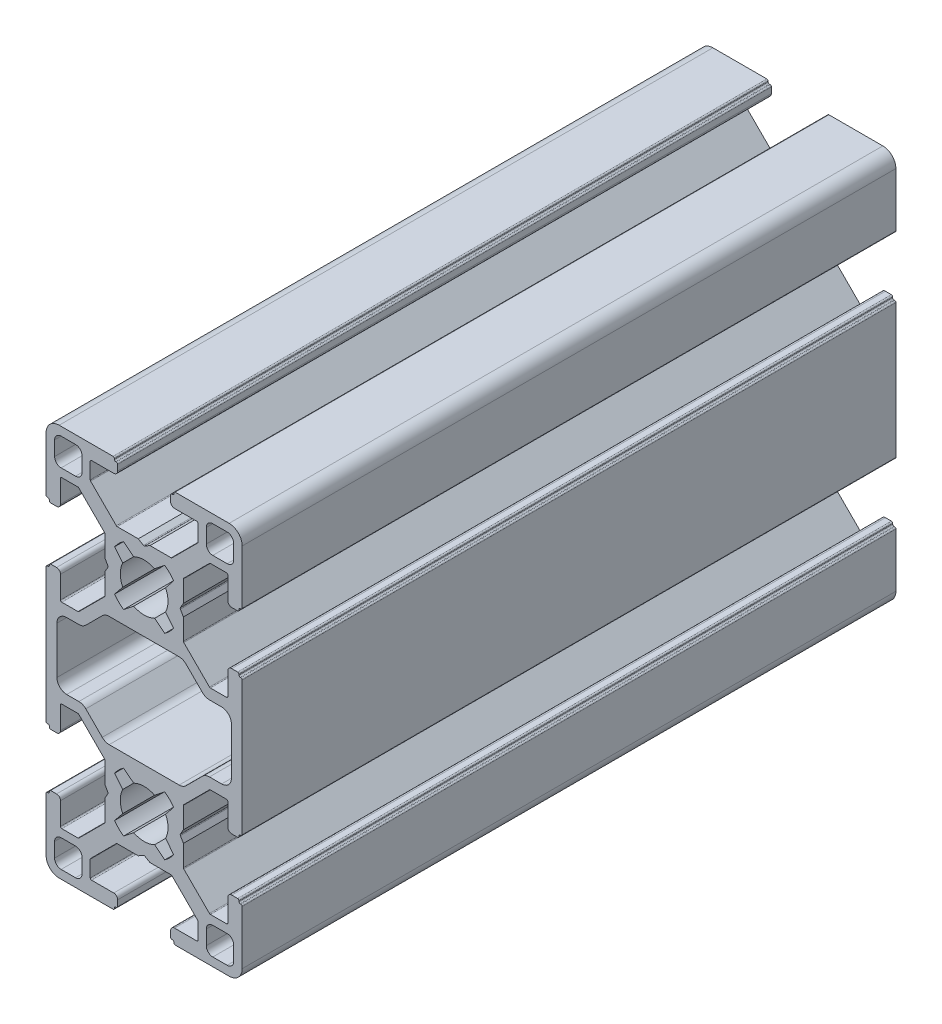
SolidWorks part; units mm, degrees
ref_plane "Front Plane" through (0, 0, 0) normal (0, 0, 1) x (1, 0, 0)
ref_plane "Top Plane" through (0, 0, 0) normal (0, 1, 0) x (1, 0, 0)
ref_plane "Right Plane" through (0, 0, 0) normal (1, 0, 0) x (0, 0, -1)
sketch "Sketch1" plane through (0, 0, 0) normal (0, 0, 1) x (1, 0, 0)
  line L0 (15.3348, -15) -> (-18.6959, -15) construction
  line L1 (-20.9994, 0) -> (26.1762, 0) construction
  line L2 (1.6001, -18.2806) -> (3.1547, -19.5053)
  line L3 (4.1172, -21) -> (0.9, -21)
  line L4 (4.35, -29.5) -> (4.25, -29.5)
  line L5 (4.05, -29.3) -> (4.05, -28.4)
  line L6 (4.55, -29.7) -> (4.55, -29.8)
  line L7 (0.9, -21) -> (0.1019, -20.5392)
  line L8 (1.6001, -11.7194) -> (3.1547, -10.4947)
  line L9 (3.2806, -13.3999) -> (4.5184, -11.8641)
  line L10 (3.2806, -16.6001) -> (4.5184, -18.1359)
  line L11 (6.0045, -19.1216) -> (6.0045, -15.9)
  line L12 (12.6, -23.25) -> (10.1328, -23.25)
  line L13 (10.5, -24.5) -> (12.7, -24.5)
  line L14 (12.7, -28.7) -> (10.5, -28.7)
  line L15 (15, -28) -> (15, -19.75)
  line L16 (13.7, -25.5) -> (13.7, -27.7)
  line L17 (14.8, -19.55) -> (14.7, -19.55)
  line L18 (14.5, -19.35) -> (14.5, -19.25)
  line L19 (14.3, -19.05) -> (13.4, -19.05)
  line L20 (12.8, -19.65) -> (12.8, -23.05)
  line L21 (8.25, -27.6) -> (8.25, -25.1328)
  line L22 (9.5, -27.7) -> (9.5, -25.5)
  line L23 (9.9914, -23.1914) -> (6.063, -19.263)
  line L24 (12.8, -10.35) -> (12.8, -6.95)
  line L25 (15, 10.25) -> (15, -10.25)
  line L26 (9.9914, -6.8086) -> (6.063, -10.737)
  line L27 (8.9272, -5.5393) -> (6.4104, -8.0562)
  line L28 (14.3, -10.95) -> (13.4, -10.95)
  line L29 (14.5, -10.65) -> (14.5, -10.75)
  line L30 (14.8, -10.45) -> (14.7, -10.45)
  line L31 (6.0045, -10.8784) -> (6.0045, -14.1)
  line L32 (6.0045, -15.9) -> (5.5426, -15.1)
  line L33 (6.0045, -14.1) -> (5.5426, -14.9)
  line L34 (12.6, -6.75) -> (10.1328, -6.75)
  line L35 (11.85, -5.1) -> (9.9879, -5.1)
  line L36 (13.35, 3.6) -> (13.35, -3.6)
  line L37 (4.75, -30) -> (13, -30)
  line L38 (8.1914, -24.9914) -> (4.2586, -21.0586)
  line L39 (4.65, -27.8) -> (8.05, -27.8)
  line L40 (-1.6001, 18.2806) -> (-3.1547, 19.5053)
  line L41 (-4.1172, 21) -> (-0.9, 21)
  line L42 (-4.35, 29.5) -> (-4.25, 29.5)
  line L43 (-4.05, 29.3) -> (-4.05, 28.4)
  line L44 (-4.55, 29.7) -> (-4.55, 29.8)
  line L45 (-0.9, 21) -> (-0.1019, 20.5392)
  line L46 (-1.6001, 11.7194) -> (-3.1547, 10.4947)
  line L47 (-5.3497, 8.4955) -> (5.3497, 8.4955)
  line L48 (-3.2806, 13.3999) -> (-4.5184, 11.8641)
  line L49 (-3.2806, 16.6001) -> (-4.5184, 18.1359)
  line L50 (-6.0045, 19.1216) -> (-6.0045, 15.9)
  line L51 (-12.6, 23.25) -> (-10.1328, 23.25)
  line L52 (-10.5, 24.5) -> (-12.7, 24.5)
  line L53 (-12.7, 28.7) -> (-10.5, 28.7)
  line L54 (-15, 28) -> (-15, 19.75)
  line L55 (-13.7, 25.5) -> (-13.7, 27.7)
  line L56 (-14.8, 19.55) -> (-14.7, 19.55)
  line L57 (-14.5, 19.35) -> (-14.5, 19.25)
  line L58 (-14.3, 19.05) -> (-13.4, 19.05)
  line L59 (-12.8, 19.65) -> (-12.8, 23.05)
  line L60 (-8.25, 27.6) -> (-8.25, 25.1328)
  line L61 (-9.5, 27.7) -> (-9.5, 25.5)
  line L62 (-9.9914, 23.1914) -> (-6.063, 19.263)
  line L63 (-12.8, 10.35) -> (-12.8, 6.95)
  line L64 (-9.9914, 6.8086) -> (-6.063, 10.737)
  line L65 (-8.9272, 5.5393) -> (-6.4104, 8.0562)
  line L66 (-14.3, 10.95) -> (-13.4, 10.95)
  line L67 (-14.5, 10.65) -> (-14.5, 10.75)
  line L68 (-14.8, 10.45) -> (-14.7, 10.45)
  line L69 (-6.0045, 10.8784) -> (-6.0045, 14.1)
  line L70 (-6.0045, 15.9) -> (-5.5426, 15.1)
  line L71 (-6.0045, 14.1) -> (-5.5426, 14.9)
  line L72 (-12.6, 6.75) -> (-10.1328, 6.75)
  line L73 (-11.85, 5.1) -> (-9.9879, 5.1)
  line L74 (-4.75, 30) -> (-13, 30)
  line L75 (-8.1914, 24.9914) -> (-4.2586, 21.0586)
  line L76 (-4.65, 27.8) -> (-8.05, 27.8)
  line L77 (4.65, 27.8) -> (8.05, 27.8)
  line L78 (8.1914, 24.9914) -> (4.2586, 21.0586)
  line L79 (4.75, 30) -> (13, 30)
  line L80 (11.85, 5.1) -> (9.9879, 5.1)
  line L81 (12.6, 6.75) -> (10.1328, 6.75)
  line L82 (6.0045, 14.1) -> (5.5426, 14.9)
  line L83 (6.0045, 15.9) -> (5.5426, 15.1)
  line L84 (6.0045, 10.8784) -> (6.0045, 14.1)
  line L85 (14.8, 10.45) -> (14.7, 10.45)
  line L86 (14.5, 10.65) -> (14.5, 10.75)
  line L87 (14.3, 10.95) -> (13.4, 10.95)
  line L88 (8.9272, 5.5393) -> (6.4104, 8.0562)
  line L89 (9.9914, 6.8086) -> (6.063, 10.737)
  line L90 (12.8, 10.35) -> (12.8, 6.95)
  line L91 (9.9914, 23.1914) -> (6.063, 19.263)
  line L92 (9.5, 27.7) -> (9.5, 25.5)
  line L93 (8.25, 27.6) -> (8.25, 25.1328)
  line L94 (12.8, 19.65) -> (12.8, 23.05)
  line L95 (14.3, 19.05) -> (13.4, 19.05)
  line L96 (14.5, 19.35) -> (14.5, 19.25)
  line L97 (14.8, 19.55) -> (14.7, 19.55)
  line L98 (13.7, 25.5) -> (13.7, 27.7)
  line L99 (15, 28) -> (15, 19.75)
  line L100 (12.7, 28.7) -> (10.5, 28.7)
  line L101 (10.5, 24.5) -> (12.7, 24.5)
  line L102 (12.6, 23.25) -> (10.1328, 23.25)
  line L103 (6.0045, 19.1216) -> (6.0045, 15.9)
  line L104 (3.2806, 16.6001) -> (4.5184, 18.1359)
  line L105 (3.2806, 13.3999) -> (4.5184, 11.8641)
  line L106 (1.6001, 11.7194) -> (3.1547, 10.4947)
  line L107 (0.9, 21) -> (0.1019, 20.5392)
  line L108 (4.55, 29.7) -> (4.55, 29.8)
  line L109 (4.05, 29.3) -> (4.05, 28.4)
  line L110 (4.35, 29.5) -> (4.25, 29.5)
  line L111 (4.1172, 21) -> (0.9, 21)
  line L112 (1.6001, 18.2806) -> (3.1547, 19.5053)
  line L155 (0, 26.7355) -> (0, -34.1789) construction
  line L156 (-4.65, -27.8) -> (-8.05, -27.8)
  line L157 (-8.1914, -24.9914) -> (-4.2586, -21.0586)
  line L158 (-4.75, -30) -> (-13, -30)
  line L162 (-13.35, 3.6) -> (-13.35, -3.6)
  line L163 (-11.85, -5.1) -> (-9.9879, -5.1)
  line L164 (-12.6, -6.75) -> (-10.1328, -6.75)
  line L165 (-6.0045, -14.1) -> (-5.5426, -14.9)
  line L166 (-6.0045, -15.9) -> (-5.5426, -15.1)
  line L167 (-6.0045, -10.8784) -> (-6.0045, -14.1)
  line L168 (-14.8, -10.45) -> (-14.7, -10.45)
  line L169 (-14.5, -10.65) -> (-14.5, -10.75)
  line L170 (-14.3, -10.95) -> (-13.4, -10.95)
  line L171 (-8.9272, -5.5393) -> (-6.4104, -8.0562)
  line L172 (-9.9914, -6.8086) -> (-6.063, -10.737)
  line L173 (-15, 10.25) -> (-15, -10.25)
  line L174 (-12.8, -10.35) -> (-12.8, -6.95)
  line L176 (-9.9914, -23.1914) -> (-6.063, -19.263)
  line L177 (-9.5, -27.7) -> (-9.5, -25.5)
  line L178 (-8.25, -27.6) -> (-8.25, -25.1328)
  line L179 (-12.8, -19.65) -> (-12.8, -23.05)
  line L180 (-14.3, -19.05) -> (-13.4, -19.05)
  line L181 (-14.5, -19.35) -> (-14.5, -19.25)
  line L182 (-14.8, -19.55) -> (-14.7, -19.55)
  line L183 (-13.7, -25.5) -> (-13.7, -27.7)
  line L184 (-15, -28) -> (-15, -19.75)
  line L185 (-12.7, -28.7) -> (-10.5, -28.7)
  line L186 (-10.5, -24.5) -> (-12.7, -24.5)
  line L187 (-12.6, -23.25) -> (-10.1328, -23.25)
  line L188 (-6.0045, -19.1216) -> (-6.0045, -15.9)
  line L214 (-3.2806, -16.6001) -> (-4.5184, -18.1359)
  line L215 (-3.2806, -13.3999) -> (-4.5184, -11.8641)
  line L216 (-5.3497, -8.4955) -> (5.3497, -8.4955)
  line L217 (-1.6001, -11.7194) -> (-3.1547, -10.4947)
  line L226 (-0.9, -21) -> (-0.1019, -20.5392)
  line L234 (-4.55, -29.7) -> (-4.55, -29.8)
  line L235 (-4.05, -29.3) -> (-4.05, -28.4)
  line L236 (-4.35, -29.5) -> (-4.25, -29.5)
  line L237 (-4.1172, -21) -> (-0.9, -21)
  line L238 (-1.6001, -18.2806) -> (-3.1547, -19.5053)
  arc A0 (4.5184, -18.1359) -> (3.1547, -19.5053) centre (0, -15) cw
  arc A1 (4.35, -29.5) -> (4.55, -29.7) centre (4.35, -29.7) cw
  arc A2 (4.25, -29.5) -> (4.05, -29.3) centre (4.25, -29.3) cw
  arc A3 (4.75, -30) -> (4.55, -29.8) centre (4.75, -29.8) cw
  arc A4 (4.05, -28.4) -> (4.65, -27.8) centre (4.65, -28.4) cw
  arc A5 (4.1172, -21) -> (4.2586, -21.0586) centre (4.1172, -21.2) cw
  arc A6 (3.2806, -13.3999) -> (3.2806, -16.6001) centre (0, -15) cw
  arc A7 (3.1547, -10.4947) -> (4.5184, -11.8641) centre (0, -15) cw
  arc A8 (12.6, -6.75) -> (12.8, -6.95) centre (12.6, -6.95) cw
  arc A9 (13.35, -3.6) -> (11.85, -5.1) centre (11.85, -3.6) cw
  arc A10 (9.9914, -6.8086) -> (10.1328, -6.75) centre (10.1328, -6.95) cw
  arc A11 (8.9272, -5.5393) -> (9.9879, -5.1) centre (9.9879, -6.6) cw
  arc A12 (15, -28) -> (13, -30) centre (13, -28) cw
  arc A13 (12.7, -24.5) -> (13.7, -25.5) centre (12.7, -25.5) cw
  arc A14 (13.7, -27.7) -> (12.7, -28.7) centre (12.7, -27.7) cw
  arc A15 (14.7, -19.55) -> (14.5, -19.35) centre (14.7, -19.35) cw
  arc A16 (14.8, -19.55) -> (15, -19.75) centre (14.8, -19.75) cw
  arc A17 (14.3, -19.05) -> (14.5, -19.25) centre (14.3, -19.25) cw
  arc A18 (12.8, -19.65) -> (13.4, -19.05) centre (13.4, -19.65) cw
  arc A19 (12.8, -23.05) -> (12.6, -23.25) centre (12.6, -23.05) cw
  arc A20 (9.5, -25.5) -> (10.5, -24.5) centre (10.5, -25.5) cw
  arc A21 (8.1914, -24.9914) -> (8.25, -25.1328) centre (8.05, -25.1328) cw
  arc A22 (8.25, -27.6) -> (8.05, -27.8) centre (8.05, -27.6) cw
  arc A23 (10.5, -28.7) -> (9.5, -27.7) centre (10.5, -27.7) cw
  arc A24 (10.1328, -23.25) -> (9.9914, -23.1914) centre (10.1328, -23.05) cw
  arc A25 (6.063, -19.263) -> (6.0045, -19.1216) centre (6.2045, -19.1216) cw
  arc A26 (14.5, -10.75) -> (14.3, -10.95) centre (14.3, -10.75) cw
  arc A27 (15, -10.25) -> (14.8, -10.45) centre (14.8, -10.25) cw
  arc A28 (14.5, -10.65) -> (14.7, -10.45) centre (14.7, -10.65) cw
  arc A29 (13.4, -10.95) -> (12.8, -10.35) centre (13.4, -10.35) cw
  arc A30 (5.5426, -15.1) -> (5.5426, -14.9) centre (5.7158, -15) cw
  arc A31 (6.0045, -10.8784) -> (6.063, -10.737) centre (6.2045, -10.8784) cw
  arc A32 (6.4104, -8.0562) -> (5.3497, -8.4955) centre (5.3497, -6.9955) cw
  arc A33 (-1.6001, 18.2806) -> (1.6001, 18.2806) centre (0, 15) cw
  arc A34 (1.6001, 11.7194) -> (-1.6001, 11.7194) centre (0, 15) cw
  arc A35 (-4.5184, 18.1359) -> (-3.1547, 19.5053) centre (0, 15) cw
  arc A36 (-4.35, 29.5) -> (-4.55, 29.7) centre (-4.35, 29.7) cw
  arc A37 (-4.25, 29.5) -> (-4.05, 29.3) centre (-4.25, 29.3) cw
  arc A38 (-4.75, 30) -> (-4.55, 29.8) centre (-4.75, 29.8) cw
  arc A39 (-4.05, 28.4) -> (-4.65, 27.8) centre (-4.65, 28.4) cw
  arc A40 (-4.1172, 21) -> (-4.2586, 21.0586) centre (-4.1172, 21.2) cw
  arc A41 (0.1019, 20.5392) -> (-0.1019, 20.5392) centre (0, 20.7158) cw
  arc A42 (-3.2806, 13.3999) -> (-3.2806, 16.6001) centre (0, 15) cw
  arc A43 (-3.1547, 10.4947) -> (-4.5184, 11.8641) centre (0, 15) cw
  arc A44 (-12.6, 6.75) -> (-12.8, 6.95) centre (-12.6, 6.95) cw
  arc A45 (-13.35, 3.6) -> (-11.85, 5.1) centre (-11.85, 3.6) cw
  arc A46 (-9.9914, 6.8086) -> (-10.1328, 6.75) centre (-10.1328, 6.95) cw
  arc A47 (-8.9272, 5.5393) -> (-9.9879, 5.1) centre (-9.9879, 6.6) cw
  arc A48 (-15, 28) -> (-13, 30) centre (-13, 28) cw
  arc A49 (-12.7, 24.5) -> (-13.7, 25.5) centre (-12.7, 25.5) cw
  arc A50 (-13.7, 27.7) -> (-12.7, 28.7) centre (-12.7, 27.7) cw
  arc A51 (-14.7, 19.55) -> (-14.5, 19.35) centre (-14.7, 19.35) cw
  arc A52 (-14.8, 19.55) -> (-15, 19.75) centre (-14.8, 19.75) cw
  arc A53 (-14.3, 19.05) -> (-14.5, 19.25) centre (-14.3, 19.25) cw
  arc A54 (-12.8, 19.65) -> (-13.4, 19.05) centre (-13.4, 19.65) cw
  arc A55 (-12.8, 23.05) -> (-12.6, 23.25) centre (-12.6, 23.05) cw
  arc A56 (-9.5, 25.5) -> (-10.5, 24.5) centre (-10.5, 25.5) cw
  arc A57 (-8.1914, 24.9914) -> (-8.25, 25.1328) centre (-8.05, 25.1328) cw
  arc A58 (-8.25, 27.6) -> (-8.05, 27.8) centre (-8.05, 27.6) cw
  arc A59 (-10.5, 28.7) -> (-9.5, 27.7) centre (-10.5, 27.7) cw
  arc A60 (-10.1328, 23.25) -> (-9.9914, 23.1914) centre (-10.1328, 23.05) cw
  arc A61 (-6.063, 19.263) -> (-6.0045, 19.1216) centre (-6.2045, 19.1216) cw
  arc A62 (-14.5, 10.75) -> (-14.3, 10.95) centre (-14.3, 10.75) cw
  arc A63 (-15, 10.25) -> (-14.8, 10.45) centre (-14.8, 10.25) cw
  arc A64 (-14.5, 10.65) -> (-14.7, 10.45) centre (-14.7, 10.65) cw
  arc A65 (-13.4, 10.95) -> (-12.8, 10.35) centre (-13.4, 10.35) cw
  arc A66 (-5.5426, 15.1) -> (-5.5426, 14.9) centre (-5.7158, 15) cw
  arc A67 (-6.0045, 10.8784) -> (-6.063, 10.737) centre (-6.2045, 10.8784) cw
  arc A68 (-6.4104, 8.0562) -> (-5.3497, 8.4955) centre (-5.3497, 6.9955) cw
  arc A69 (6.4104, 8.0562) -> (5.3497, 8.4955) centre (5.3497, 6.9955) ccw
  arc A70 (6.0045, 10.8784) -> (6.063, 10.737) centre (6.2045, 10.8784) ccw
  arc A71 (5.5426, 15.1) -> (5.5426, 14.9) centre (5.7158, 15) ccw
  arc A72 (13.4, 10.95) -> (12.8, 10.35) centre (13.4, 10.35) ccw
  arc A73 (14.5, 10.65) -> (14.7, 10.45) centre (14.7, 10.65) ccw
  arc A74 (15, 10.25) -> (14.8, 10.45) centre (14.8, 10.25) ccw
  arc A75 (14.5, 10.75) -> (14.3, 10.95) centre (14.3, 10.75) ccw
  arc A76 (6.063, 19.263) -> (6.0045, 19.1216) centre (6.2045, 19.1216) ccw
  arc A77 (10.1328, 23.25) -> (9.9914, 23.1914) centre (10.1328, 23.05) ccw
  arc A78 (10.5, 28.7) -> (9.5, 27.7) centre (10.5, 27.7) ccw
  arc A79 (8.25, 27.6) -> (8.05, 27.8) centre (8.05, 27.6) ccw
  arc A80 (8.1914, 24.9914) -> (8.25, 25.1328) centre (8.05, 25.1328) ccw
  arc A81 (9.5, 25.5) -> (10.5, 24.5) centre (10.5, 25.5) ccw
  arc A82 (12.8, 23.05) -> (12.6, 23.25) centre (12.6, 23.05) ccw
  arc A83 (12.8, 19.65) -> (13.4, 19.05) centre (13.4, 19.65) ccw
  arc A84 (14.3, 19.05) -> (14.5, 19.25) centre (14.3, 19.25) ccw
  arc A85 (14.8, 19.55) -> (15, 19.75) centre (14.8, 19.75) ccw
  arc A86 (14.7, 19.55) -> (14.5, 19.35) centre (14.7, 19.35) ccw
  arc A87 (13.7, 27.7) -> (12.7, 28.7) centre (12.7, 27.7) ccw
  arc A88 (12.7, 24.5) -> (13.7, 25.5) centre (12.7, 25.5) ccw
  arc A89 (15, 28) -> (13, 30) centre (13, 28) ccw
  arc A90 (8.9272, 5.5393) -> (9.9879, 5.1) centre (9.9879, 6.6) ccw
  arc A91 (9.9914, 6.8086) -> (10.1328, 6.75) centre (10.1328, 6.95) ccw
  arc A92 (13.35, 3.6) -> (11.85, 5.1) centre (11.85, 3.6) ccw
  arc A93 (12.6, 6.75) -> (12.8, 6.95) centre (12.6, 6.95) ccw
  arc A94 (3.1547, 10.4947) -> (4.5184, 11.8641) centre (0, 15) ccw
  arc A95 (3.2806, 13.3999) -> (3.2806, 16.6001) centre (0, 15) ccw
  arc A96 (4.1172, 21) -> (4.2586, 21.0586) centre (4.1172, 21.2) ccw
  arc A97 (4.05, 28.4) -> (4.65, 27.8) centre (4.65, 28.4) ccw
  arc A98 (4.75, 30) -> (4.55, 29.8) centre (4.75, 29.8) ccw
  arc A99 (4.25, 29.5) -> (4.05, 29.3) centre (4.25, 29.3) ccw
  arc A100 (4.35, 29.5) -> (4.55, 29.7) centre (4.35, 29.7) ccw
  arc A101 (4.5184, 18.1359) -> (3.1547, 19.5053) centre (0, 15) ccw
  arc A138 (-6.4104, -8.0562) -> (-5.3497, -8.4955) centre (-5.3497, -6.9955) ccw
  arc A140 (-6.0045, -10.8784) -> (-6.063, -10.737) centre (-6.2045, -10.8784) ccw
  arc A141 (-5.5426, -15.1) -> (-5.5426, -14.9) centre (-5.7158, -15) ccw
  arc A142 (-13.4, -10.95) -> (-12.8, -10.35) centre (-13.4, -10.35) ccw
  arc A143 (-14.5, -10.65) -> (-14.7, -10.45) centre (-14.7, -10.65) ccw
  arc A144 (-15, -10.25) -> (-14.8, -10.45) centre (-14.8, -10.25) ccw
  arc A145 (-14.5, -10.75) -> (-14.3, -10.95) centre (-14.3, -10.75) ccw
  arc A147 (-6.063, -19.263) -> (-6.0045, -19.1216) centre (-6.2045, -19.1216) ccw
  arc A148 (-10.1328, -23.25) -> (-9.9914, -23.1914) centre (-10.1328, -23.05) ccw
  arc A149 (-10.5, -28.7) -> (-9.5, -27.7) centre (-10.5, -27.7) ccw
  arc A150 (-8.25, -27.6) -> (-8.05, -27.8) centre (-8.05, -27.6) ccw
  arc A151 (-8.1914, -24.9914) -> (-8.25, -25.1328) centre (-8.05, -25.1328) ccw
  arc A152 (-9.5, -25.5) -> (-10.5, -24.5) centre (-10.5, -25.5) ccw
  arc A153 (-12.8, -23.05) -> (-12.6, -23.25) centre (-12.6, -23.05) ccw
  arc A154 (-12.8, -19.65) -> (-13.4, -19.05) centre (-13.4, -19.65) ccw
  arc A155 (-14.3, -19.05) -> (-14.5, -19.25) centre (-14.3, -19.25) ccw
  arc A156 (-14.8, -19.55) -> (-15, -19.75) centre (-14.8, -19.75) ccw
  arc A157 (-14.7, -19.55) -> (-14.5, -19.35) centre (-14.7, -19.35) ccw
  arc A158 (-13.7, -27.7) -> (-12.7, -28.7) centre (-12.7, -27.7) ccw
  arc A159 (-12.7, -24.5) -> (-13.7, -25.5) centre (-12.7, -25.5) ccw
  arc A160 (-15, -28) -> (-13, -30) centre (-13, -28) ccw
  arc A184 (-8.9272, -5.5393) -> (-9.9879, -5.1) centre (-9.9879, -6.6) ccw
  arc A185 (-9.9914, -6.8086) -> (-10.1328, -6.75) centre (-10.1328, -6.95) ccw
  arc A186 (-13.35, -3.6) -> (-11.85, -5.1) centre (-11.85, -3.6) ccw
  arc A187 (-12.6, -6.75) -> (-12.8, -6.95) centre (-12.6, -6.95) ccw
  arc A188 (-3.1547, -10.4947) -> (-4.5184, -11.8641) centre (0, -15) ccw
  arc A189 (-3.2806, -13.3999) -> (-3.2806, -16.6001) centre (0, -15) ccw
  arc A198 (0.1019, -20.5392) -> (-0.1019, -20.5392) centre (0, -20.7158) ccw
  arc A203 (-4.1172, -21) -> (-4.2586, -21.0586) centre (-4.1172, -21.2) ccw
  arc A204 (-4.05, -28.4) -> (-4.65, -27.8) centre (-4.65, -28.4) ccw
  arc A205 (-4.75, -30) -> (-4.55, -29.8) centre (-4.75, -29.8) ccw
  arc A206 (-4.25, -29.5) -> (-4.05, -29.3) centre (-4.25, -29.3) ccw
  arc A207 (-4.35, -29.5) -> (-4.55, -29.7) centre (-4.35, -29.7) ccw
  arc A208 (-4.5184, -18.1359) -> (-3.1547, -19.5053) centre (0, -15) ccw
  arc A261 (1.6001, -11.7194) -> (-1.6001, -11.7194) centre (0, -15) ccw
  arc A263 (-1.6001, -18.2806) -> (1.6001, -18.2806) centre (0, -15) ccw
  point P178 (0, -8.4955)
  point P382 (0, 8.4955)
  point P385 (-15, 0)
  point P387 (-13.35, 0)
  point P388 (13.35, 0)
  point P390 (15, 0)
extrude "Extrude1" add sketch "Sketch1" along normal blind 100
